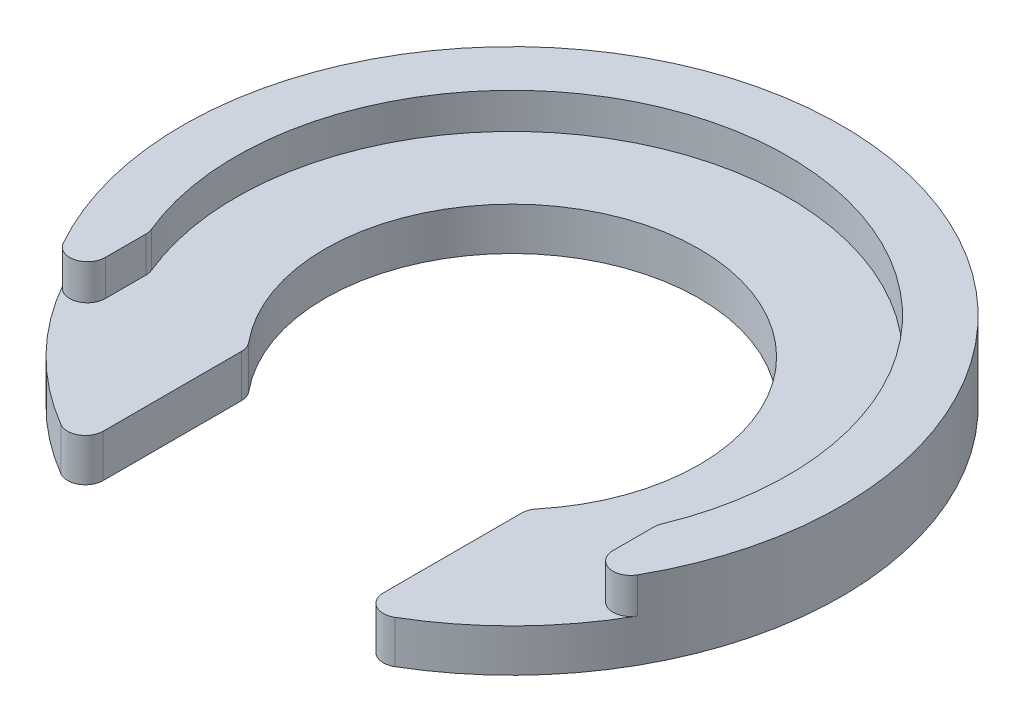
SolidWorks part; units mm, degrees
ref_plane "Plan de face" through (0, 0, 0) normal (0, 0, 1) x (1, 0, 0)
ref_plane "Plan de dessus" through (0, 0, 0) normal (0, 1, 0) x (1, 0, 0)
ref_plane "Plan de droite" through (0, 0, 0) normal (1, 0, 0) x (0, 0, -1)
sketch "Esquisse1" plane through (0, 0, 0) normal (0, 0, 1) x (1, 0, 0)
  line L0 (0, 0) -> (0, 16.9366) construction
  line L1 (-18.5, 0) -> (-10.5, 0)
  line L2 (-10.5, 0) -> (-10.5, 2.4)
  line L3 (-10.5, 2.4) -> (-15.5, 2.4)
  line L4 (-15.5, 2.4) -> (-15.5, 4.4)
  line L5 (-15.5, 4.4) -> (-18.5, 4.4)
  line L6 (-18.5, 4.4) -> (-18.5, 0)
  dimension "D1" = 31
  dimension "D2" = 5
  dimension "D3" = 2.4
  dimension "D4" = 3
  dimension "D5" = 2
revolve "Révolution1" add sketch "Esquisse1" angle 360 about L0
sketch "Esquisse2" plane through (0, 2.4, 0) normal (0, 1, 0) x (1, 0, 0)
  line L0 (0, 0) -> (0, -20.3872) construction
  line L1 (7.8614, 0) -> (7.8614, -20.3872)
  line L2 (-7.8614, 0) -> (-7.8614, -20.3872)
  arc A0 (7.8614, 0) -> (-7.8614, 0) centre (0, 0) ccw
  arc A1 (-7.8614, -20.3872) -> (7.8614, -20.3872) centre (0, -20.3872) ccw
  point P3 (0, -10.1936)
extrude "Enlèv. mat.-Extru.1" cut sketch "Esquisse2" against normal through all both and the other way through all
sketch "Esquisse3" plane through (0, 2.4, 0) normal (0, 1, 0) x (1, 0, 0)
  line L0 (0, 0) -> (0, -18.5005) construction
  line L1 (14.25, 0) -> (14.25, -18.5005)
  line L2 (-14.25, 0) -> (-14.25, -18.5005)
  arc A0 (14.25, 0) -> (-14.25, 0) centre (0, 0) ccw
  arc A1 (-14.25, -18.5005) -> (14.25, -18.5005) centre (0, -18.5005) ccw
  point P3 (0, -9.2503)
  dimension "D1" = 28.5
extrude "Enlèv. mat.-Extru.2" cut sketch "Esquisse3" along normal blind 10
fillet "Congé2" radius 1 8 edges at (-14.25, 3.4, 6.0982) (14.25, 3.4, 6.0982) (14.25, 3.4, 11.7978) (-14.25, 3.4, 11.7978) (7.8614, 1.2, 6.9605) (-7.8614, 1.2, 6.9605) (7.8614, 1.2, 16.7466) (-7.8614, 1.2, 16.7466)
